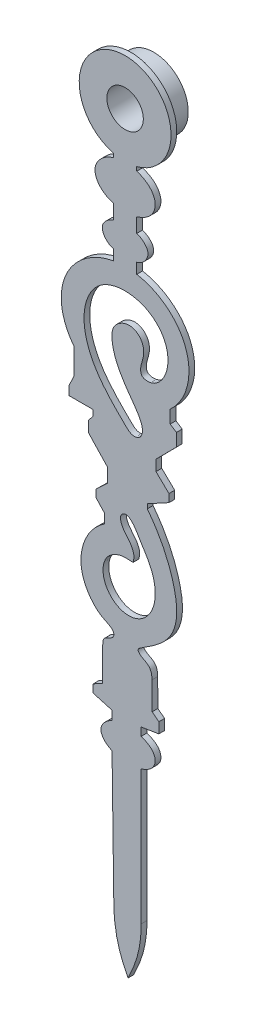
SolidWorks part; units mm, degrees
ref_plane "Спереди" through (0, 0, 0) normal (0, 0, 1) x (1, 0, 0)
ref_plane "Сверху" through (0, 0, 0) normal (0, 1, 0) x (1, 0, 0)
ref_plane "Справа" through (0, 0, 0) normal (1, 0, 0) x (0, 0, -1)
sketch "Эскиз1" plane through (0, 0, 0) normal (0, 0, 1) x (1, 0, 0)
  line L21 (0.0883, -6.2807) -> (1.3935, -6.316)
  line L37 (-2.0284, 53.7243) -> (-2.0284, 53.0213)
  line L52 (-2.0284, 46.1421) -> (-2.0284, 43.6374)
  line L64 (-2.0284, 39.2982) -> (-2.0284, 37.4638)
  line L83 (-8.8723, 21.1301) -> (-8.8723, 16.6851)
  line L84 (-8.8723, 16.6851) -> (-9.7542, 14.8507)
  line L85 (-9.7542, 14.8507) -> (-9.7542, 13.2632)
  line L86 (-9.7542, 13.2632) -> (-5.5562, 13.2632)
  line L87 (-5.5562, 13.2632) -> (-5.5562, 12.2401)
  line L88 (-5.5562, 12.2401) -> (-6.4028, 11.2524)
  line L89 (-6.4028, 11.2524) -> (-6.4028, 9.3827)
  line L90 (-6.4028, 9.3827) -> (-3.0515, 5.8196)
  line L91 (-3.0515, 5.8196) -> (-3.0515, 3.4207)
  line L92 (-3.0515, 3.4207) -> (-5.0623, 1.5157)
  line L93 (-5.0623, 1.5157) -> (-5.0623, 0.2104)
  line L94 (-5.0623, 0.2104) -> (-3.5806, -1.3771)
  line L95 (-3.5806, -1.3771) -> (-3.5806, -2.9999)
  line L120 (-3.8981, -21.6618) -> (-3.8981, -27.2004)
  line L121 (-3.8981, -27.2004) -> (-5.5562, -28.1176)
  line L122 (-5.5562, -28.1176) -> (-5.5562, -29.5287)
  line L123 (-5.5562, -29.5287) -> (-2.2753, -30.446)
  line L124 (-2.2753, -30.446) -> (-2.2753, -32.0335)
  line L135 (-2.2753, -36.5843) -> (-1.9578, -60.1499)
  line L152 (2.8047, -60.1499) -> (2.8047, -36.796)
  line L165 (2.8047, -31.8571) -> (2.8047, -30.446)
  line L166 (2.8047, -30.446) -> (5.8738, -29.9521)
  line L167 (5.8738, -29.9521) -> (5.8738, -28.1176)
  line L168 (5.8738, -28.1176) -> (4.7097, -27.2004)
  line L169 (4.7097, -27.2004) -> (4.6744, -22.4026)
  line L195 (3.863, 2.9974) -> (3.863, 3.7735)
  line L196 (3.863, 3.7735) -> (7.6377, 5.8196)
  line L197 (7.6377, 5.8196) -> (7.6377, 7.1954)
  line L198 (7.6377, 7.1954) -> (5.3799, 9.3827)
  line L199 (5.3799, 9.3827) -> (5.3799, 11.2524)
  line L200 (5.3799, 11.2524) -> (8.943, 14.8507)
  line L201 (8.943, 14.8507) -> (8.943, 17.0732)
  line L202 (8.943, 17.0732) -> (7.8494, 17.7788)
  line L203 (7.8494, 17.7788) -> (7.8494, 20.0365)
  line L223 (2.0285, 37.4638) -> (2.0285, 39.2982)
  line L235 (2.0285, 43.6374) -> (2.0285, 46.1421)
  line L250 (2.0285, 53.0213) -> (2.0285, 53.7243)
  line L316 (0, 75.1459) -> (0, -91.9163) construction
  line L317 (-13.2315, 61.4629) -> (21.1864, 61.4629) construction
  circle A0 centre (0, 61.4629) radius 3.175
  arc A1 (2.0285, 53.7243) -> (-2.0284, 53.7243) centre (0, 61.4629) ccw
  spline S0 degree 3 poles (-2.0284, 53.0213) (-3.03, 52.7594) (-4.3171, 51.9335) (-5.2715, 50.255) (-5.2621, 48.9005) (-4.3526, 47.1938) (-2.9939, 46.426) (-2.0284, 46.1421) knots 0 0 0 0 0.307109 0.437946 0.561301 0.695274 1 1 1 1
  spline S1 degree 3 poles (2.0285, 53.0213) (3.0024, 52.726) (4.379, 51.9678) (5.2648, 50.2427) (5.2556, 48.9126) (4.414, 47.1599) (2.9673, 46.4593) (2.0285, 46.1421) knots 0 0 0 0 0.309048 0.438038 0.561131 0.693287 1 1 1 1
  spline S2 degree 3 poles (-2.0284, 43.6374) (-2.8461, 43.3452) (-5.0317, 41.7002) (-3.0147, 39.4587) (-2.0284, 39.2982) knots 0 0 0 0 0.462212 1 1 1 1
  spline S3 degree 3 poles (2.0285, 43.6374) (2.8644, 43.3797) (5.0185, 41.685) (3.0192, 39.4638) (2.0285, 39.2982) knots 0 0 0 0 0.463108 1 1 1 1
  spline S4 degree 3 poles (-2.0284, 37.4638) (-5.2285, 36.9292) (-9.6747, 33.9945) (-11.7719, 26.8732) (-10.3337, 22.9315) (-8.8723, 21.1301) knots 0 0 0 0 0.455417 0.672007 1 1 1 1
  spline S5 degree 3 poles (2.0285, 37.4638) (5.2683, 36.936) (9.8039, 33.9223) (11.8626, 26.2435) (9.9097, 21.8776) (7.8494, 20.0365) knots 0 0 0 0 0.431377 0.637463 1 1 1 1
  spline S6 degree 3 poles (-5.9819, 19.6529) (-1.8504, 15.5373) (1.0484, 12.716) (2.4806, 12.8274) (3.2556, 14.2441) (2.6624, 15.9657) (1.3801, 17.8777) (-0.2517, 20.018) (-1.6943, 22.6634) (-2.3763, 25.1916) (-2.2564, 27.4643) (-0.8853, 28.7749) (0.8587, 29.349) (2.6649, 28.4782) (3.4237, 26.6602) (3.048, 24.9574) (2.6146, 23.7007) (2.8318, 22.2865) (4.528, 22.1729) (5.9395, 23.032) (7.5148, 25.2709) (7.7339, 29.5076) (3.5014, 34.4106) (-4.6107, 34.2373) (-7.8962, 27.149) (-5.9819, 19.6529) (-1.8504, 15.5373) (1.0484, 12.716) knots -0.293568 -0.216728 -0.123393 0 0.018038 0.034281 0.04942 0.076033 0.102239 0.143443 0.184194 0.222749 0.24912 0.27026 0.295355 0.318488 0.343974 0.368401 0.386826 0.398565 0.41941 0.439785 0.465602 0.526455 0.594804 0.706432 0.783272 0.876607 1 1.018038 1.034281 1.04942 only from (0.0883, 13.6513) to (0.0883, 13.6513)
  spline S7 degree 3 poles (-3.5806, -2.9999) (-5.6279, -4.3414) (-7.6249, -7.3626) (-7.7917, -11.7707) (-6.666, -14.7558) (-4.7684, -17.0031) (-2.8208, -17.7587) (-1.9242, -18.4791) (-1.9819, -19.4002) (-2.8103, -19.8112) (-3.9138, -20.2472) (-3.8981, -21.2356) (-3.8981, -21.6618) knots 0 0 0 0 0.312275 0.435687 0.557103 0.720937 0.791808 0.832793 0.855688 0.898038 0.941145 1 1 1 1
  spline S8 degree 3 poles (4.6744, -22.4026) (4.6674, -21.4519) (4.3942, -20.6368) (3.1886, -19.9811) (2.5452, -19.6493) (2.0883, -18.949) (3.7007, -17.9514) (5.378, -16.8507) (8.031, -14.5369) (9.2809, -10.7847) (8.3774, -4.4376) (6.0759, 0.1824) (3.863, 2.9974) knots 0 0 0 0 0.066744 0.099742 0.128204 0.140209 0.173229 0.268948 0.375303 0.501812 0.64463 1 1 1 1
  spline S9 degree 3 poles (1.3935, -6.316) (1.4683, -5.9863) (1.6669, -5.1108) (1.0361, -3.7031) (-0.0369, -2.5669) (-0.7899, -1.4019) (-0.874, -0.1483) (0.2231, 0.5351) (1.6025, -0.5289) (2.4386, -2.2132) (4.05, -4.5223) (5.3776, -7.4927) (5.2525, -11.0124) (3.8035, -13.6046) (1.4212, -14.9376) (-1.3929, -14.565) (-3.4829, -12.4887) (-4.0521, -9.8952) (-3.1628, -7.1822) (-1.1273, -6.2478) (0.0883, -6.2807) knots 0 0 0 0 0.025126 0.066717 0.108477 0.143854 0.171451 0.191414 0.226376 0.28206 0.338745 0.437225 0.522618 0.595136 0.651569 0.718673 0.79406 0.859393 0.909408 1 1 1 1
  spline S10 degree 3 poles (-2.2753, -32.0335) (-3.0542, -32.3288) (-4.628, -33.6396) (-3.7997, -35.7227) (-2.8722, -36.288) (-2.2753, -36.5843) knots 0 0 0 0 0.500675 0.674614 1 1 1 1
  spline S11 degree 3 poles (2.8047, -31.8571) (3.5788, -32.1497) (4.86, -32.742) (5.3447, -34.3265) (4.8599, -35.911) (3.5789, -36.5034) (2.8047, -36.796) knots 0 0 0 0 0.360268 0.499995 0.639722 1 1 1 1
  spline S12 degree 3 poles (-1.9578, -60.1499) (-1.9469, -60.9624) (-1.7782, -62.5778) (-1.1973, -65.7699) (-0.2435, -68.0317) (0.5116, -69.4632) knots 0 0 0 0 0.251367 0.499072 1 1 1 1
  spline S13 degree 3 poles (0.5116, -69.4632) (1.222, -68.0197) (2.1588, -65.7659) (2.7102, -62.5774) (2.8047, -60.9609) (2.8047, -60.1499) knots 0 0 0 0 0.50013 0.748155 1 1 1 1
  dimension "D1" = 6.35
  dimension "D2" = 16
extrude "Бобышка-Вытянуть1" add sketch "Эскиз1" along normal blind 1
sketch "Эскиз3" plane through (0, 0, 0) normal (0, 0, -1) x (-1, 0, 0)
  circle A0 centre (0, 61.4629) radius 6
  circle A1 centre (0, 61.4629) radius 3.175 construction
  circle A2 centre (0, 61.4629) radius 3.175
  dimension "D1" = 12
extrude "Бобышка-Вытянуть2" add sketch "Эскиз3" along normal blind 4
